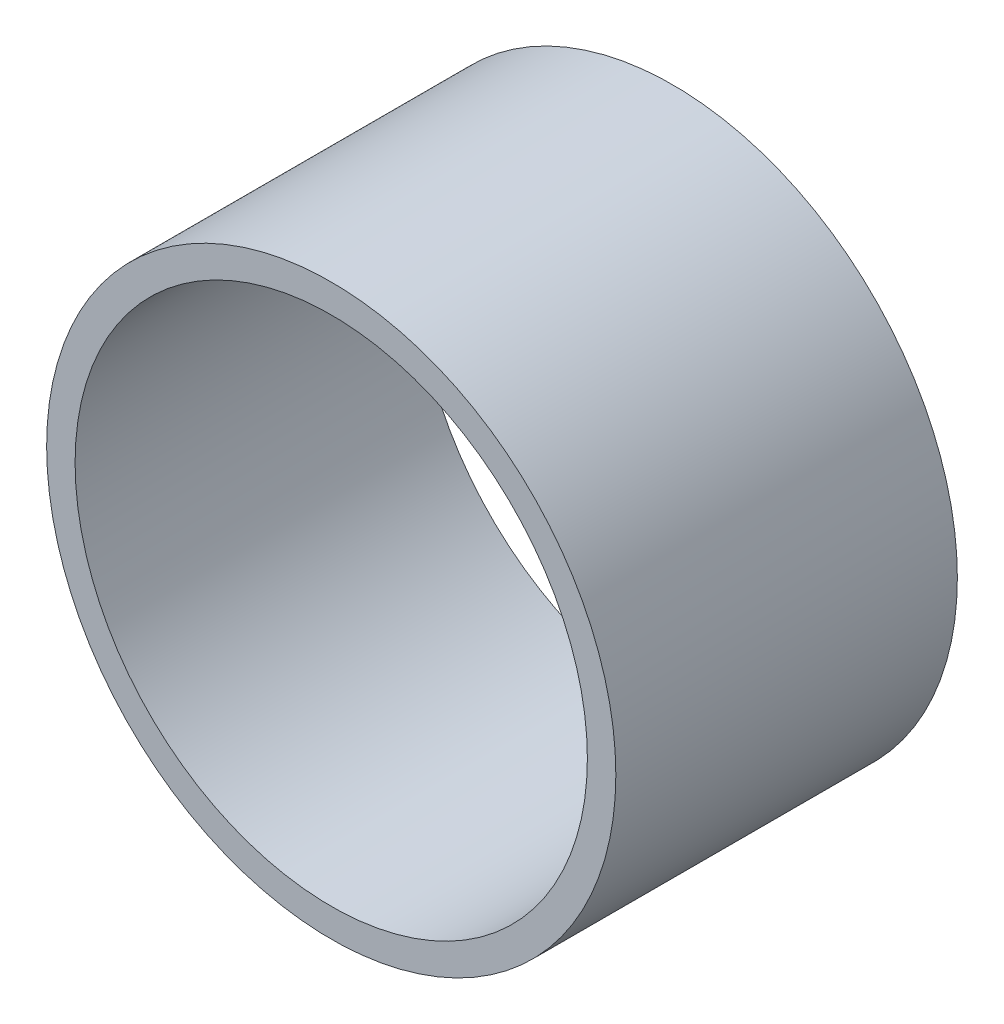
SolidWorks part; units mm, degrees
ref_plane "Front Plane" through (0, 0, 0) normal (0, 0, 1) x (1, 0, 0)
ref_plane "Top Plane" through (0, 0, 0) normal (0, 1, 0) x (1, 0, 0)
ref_plane "Right Plane" through (0, 0, 0) normal (1, 0, 0) x (0, 0, -1)
sketch "Sketch1" plane through (0, 0, 0) normal (0, 0, 1) x (1, 0, 0)
  circle A0 centre (0, 0) radius 250
  circle A1 centre (0, 0) radius 225
  dimension "D1" = 500
  dimension "D2" = 450
extrude "Boss-Extrude1" add sketch "Sketch1" along normal blind 300
